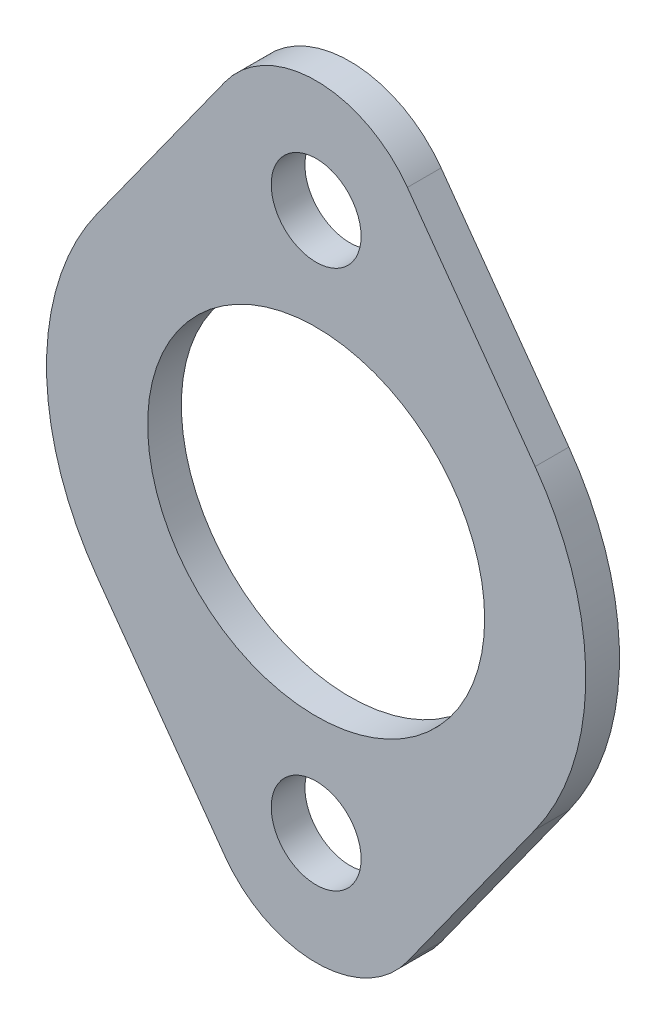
SolidWorks part; units mm, degrees
ref_plane "Front" through (0, 0, 0) normal (0, 0, 1) x (1, 0, 0)
ref_plane "Top" through (0, 0, 0) normal (0, 1, 0) x (1, 0, 0)
ref_plane "Right" through (0, 0, 0) normal (1, 0, 0) x (0, 0, -1)
sketch "Sketch1" plane through (0, 0, 0) normal (0, 0, 1) x (1, 0, 0)
  line L0 (0, 0) -> (0, 94.4945) construction
  line L1 (0, 0) -> (88.837, 0) construction
  line L2 (12.8942, 47.3604) -> (30.9461, 22.225)
  line L3 (12.8942, -47.3604) -> (30.9461, -22.225)
  line L4 (-12.8942, 47.3604) -> (-30.9461, 22.225)
  line L5 (-12.8942, -47.3604) -> (-30.9461, -22.225)
  arc A0 (-12.8942, 47.3604) -> (12.8942, 47.3604) centre (0, 38.1) cw
  arc A1 (-12.8942, -47.3604) -> (12.8942, -47.3604) centre (0, -38.1) ccw
  arc A2 (30.9461, 22.225) -> (30.9461, -22.225) centre (0, 0) cw
  arc A3 (-30.9461, -22.225) -> (-30.9461, 22.225) centre (0, 0) cw
  dimension "EndR" = 15.875
  dimension "SideR" = 38.1
  dimension "CtoC" = 76.2
extrude "Main" add sketch "Sketch1" along normal blind 4.7625
sketch "Sketch2" plane through (0, 0, 4.7625) normal (0, 0, 1) x (1, 0, 0)
  circle A0 centre (0, 38.1) radius 6.35
  circle A1 centre (0, -38.1) radius 6.35
  circle A2 centre (0, 0) radius 23.8125
  dimension "BoltH" = 12.7
  dimension "CenterH" = 47.625
extrude "Holes" cut sketch "Sketch2" against normal through all
